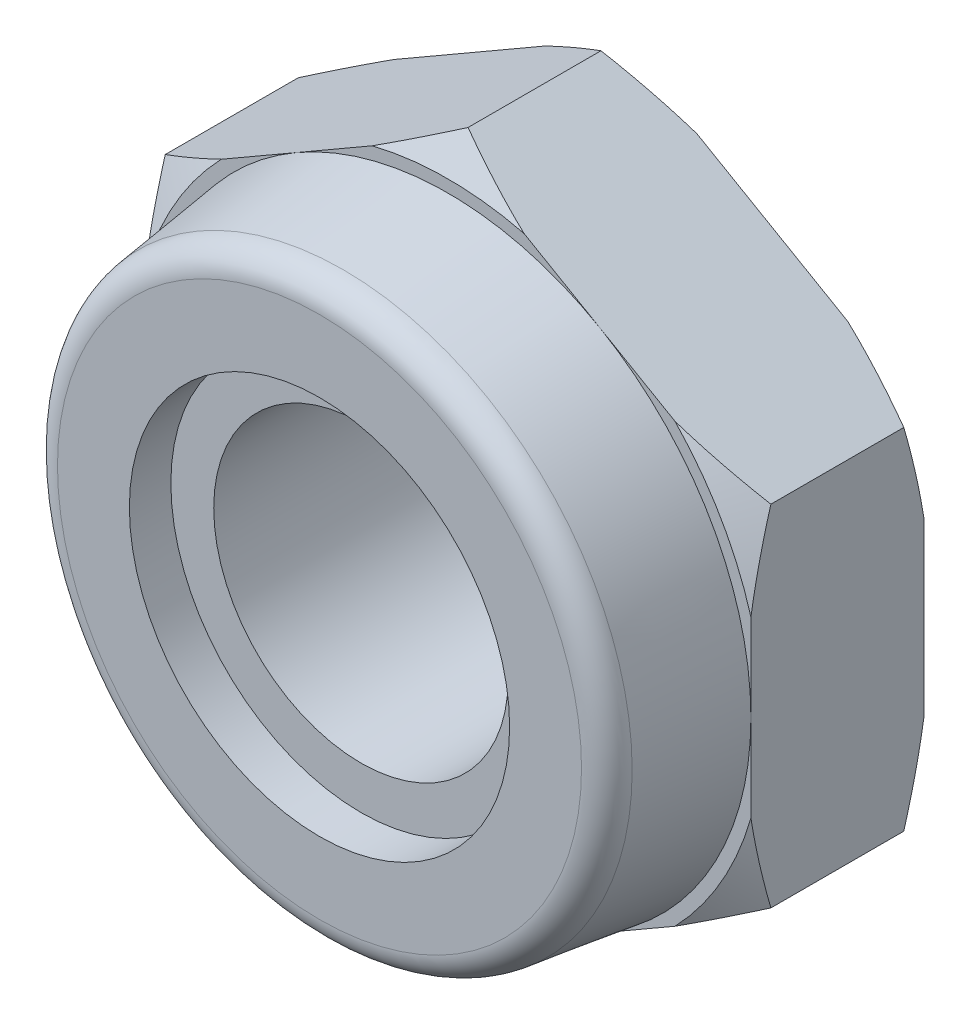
SolidWorks part; units mm, degrees
ref_plane "Front" through (0, 0, 0) normal (0, 0, 1) x (1, 0, 0)
ref_plane "Top" through (0, 0, 0) normal (0, 1, 0) x (1, 0, 0)
ref_plane "Right" through (0, 0, 0) normal (1, 0, 0) x (0, 0, -1)
sketch "BaseNutSke" plane through (0, 0, 0) normal (0, 0, 1) x (1, 0, 0)
  line L1 (5.5626, -3.2116) -> (5.5626, 3.2116)
  line L2 (5.5626, 3.2116) -> (0, 6.4231)
  line L3 (0, 6.4231) -> (-5.5626, 3.2116)
  line L4 (-5.5626, 3.2116) -> (-5.5626, -3.2116)
  line L5 (-5.5626, -3.2116) -> (0, -6.4231)
  line L12 (0, -6.4231) -> (5.5626, -3.2116)
  circle A0 centre (0, 0) radius 2.7051
  circle A2 centre (0, 0) radius 5.5626 construction
  dimension "Tap_Drill" = 5.4102
  dimension "A" = 11.1252
extrude "BaseNut" add sketch "BaseNutSke" against normal blind 3.175
sketch "TorqEleSke" plane through (0, 0, 0) normal (0, 1, 0) x (0, 0, -1)
  line L0 (-9.4809, 0) -> (15.875, 0) construction
  line L1 (0, 0) -> (0, 5.5626) construction
  line L2 (-1.6002, 3.4925) -> (-1.6002, 2.7051)
  line L3 (0, 2.7051) -> (0, 5.5626)
  line L4 (0, 5.5626) -> (-1.9275, 5.3088)
  line L5 (-1.6002, 2.7051) -> (0, 2.7051)
  line L6 (-1.6002, 3.4925) -> (-2.3622, 3.4925)
  line L7 (-2.3622, 3.4925) -> (-2.3622, 4.8131)
  line L10 (0, -5.5626) -> (0, 0) construction
  line L11 (3.175, -5.5626) -> (3.175, 0) construction
  arc A0 (-2.3622, 4.8131) -> (-1.9275, 5.3088) centre (-1.8622, 4.8131) cw
revolve "TorqueElement" add sketch "TorqEleSke" angle 360 about L0
sketch "Sketch3" plane through (0, 0, 0) normal (1, 0, 0) x (0, 0, -1)
  line L0 (3.175, 5.7881) -> (2.8084, 6.4231)
  line L1 (0, 6.4231) -> (0, 5.7881)
  line L2 (2.8084, 6.4231) -> (3.175, 6.4231)
  line L3 (3.175, 6.4231) -> (3.175, 5.7881)
  line L4 (0.3666, 6.4231) -> (0, 6.4231)
  line L5 (0, 5.7881) -> (0.3666, 6.4231)
  line L7 (0, 0) -> (38.6776, 0) construction
  line L9 (1.5875, 4.0415) -> (1.5875, 50004.0415) construction
  line L15 (3.175, 6.4231) -> (0, 6.4231) construction
  point P23 (1.5875, 6.4231)
revolve "DoubleChamfer" cut sketch "Sketch3" angle 360 about L7
sketch "ThdSchSke" plane through (0, 0, 0) normal (0, 1, 0) x (1, 0, 0)
  line L0 (-3.175, 3.175) -> (-2.7051, 3.4463)
  line L1 (-3.175, 3.175) -> (-50003.175, 3.175) construction
  line L2 (-2.7051, 3.4463) -> (-2.7051, 2.9037)
  line L3 (2.7051, 3.175) -> (-2.7051, 3.175) construction
  line L4 (-2.7051, 2.9037) -> (-3.175, 3.175)
  line L6 (0, -1.4815) -> (0, -2.9874) construction
  line L7 (-2.7051, 3.175) -> (-2.7051, -1.6002) construction
revolve "ThreadSchematic" cut sketch "ThdSchSke" angle 360 about L6
pattern_linear "ThdSchPat" [suppressed]
equation "\"Inset_Dia@TorqEleSke\" = \"ThreadSize@ThdSchSke\" * 1.1"
equation "\"D3@TorqEleSke\" = \"ThreadSize@ThdSchSke\" * .12"
equation "\"ChamferLen@Sketch3\"=\"ThreadSize@ThdSchSke\"*.1"
